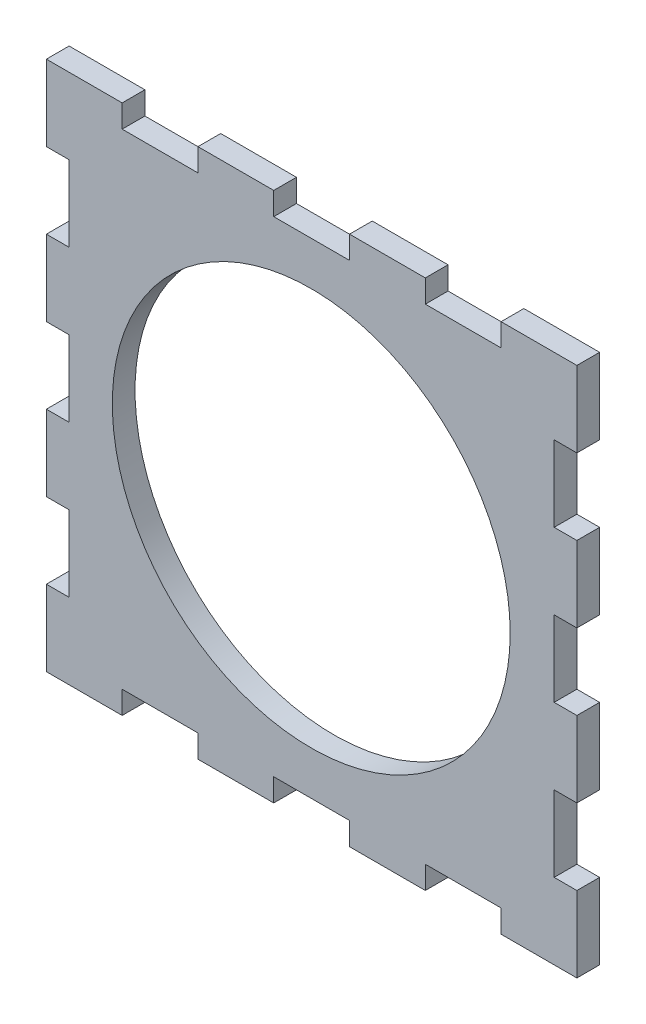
SolidWorks part; units mm, degrees
ref_plane "Front Plane" through (0, 0, 0) normal (0, 0, 1) x (1, 0, 0)
ref_plane "Top Plane" through (0, 0, 0) normal (0, 1, 0) x (1, 0, 0)
ref_plane "Right Plane" through (0, 0, 0) normal (1, 0, 0) x (0, 0, -1)
sketch "Sketch1" plane through (0, 0, 0) normal (0, 0, 1) x (1, 0, 0)
  line L1 (-28.6885, 13.1967) -> (41.3115, 13.1967)
  line L2 (-28.6885, 13.1967) -> (-28.6885, -56.8033)
  line L3 (-28.6885, -56.8033) -> (41.3115, -56.8033)
  line L4 (41.3115, 13.1967) -> (41.3115, -56.8033)
  line L5 (-28.6885, 13.1967) -> (41.3115, -56.8033) construction
  line L6 (-28.6885, -56.8033) -> (41.3115, 13.1967) construction
  point P4 (6.3115, -21.8033)
extrude "Boss-Extrude1" add sketch "Sketch1" along normal blind 3
sketch "Sketch2" plane through (0, 0, 3) normal (0, 0, 1) x (1, 0, 0)
  line L0 (41.3115, 13.1967) -> (-28.6885, 13.1967) construction
  line L1 (-18.6885, 13.1967) -> (-8.6885, 13.1967)
  line L2 (-18.6885, 13.1967) -> (-18.6885, 10.1967)
  line L3 (-18.6885, 10.1967) -> (-8.6885, 10.1967)
  line L4 (-8.6885, 13.1967) -> (-8.6885, 10.1967)
  line L5 (-18.6885, 13.1967) -> (-8.6885, 10.1967) construction
  line L6 (-18.6885, 10.1967) -> (-8.6885, 13.1967) construction
  line L7 (1.3115, 13.1967) -> (11.3115, 13.1967)
  line L8 (1.3115, 13.1967) -> (1.3115, 10.1967)
  line L9 (1.3115, 10.1967) -> (11.3115, 10.1967)
  line L10 (11.3115, 13.1967) -> (11.3115, 10.1967)
  line L11 (21.3115, 13.1967) -> (31.3115, 13.1967)
  line L12 (21.3115, 13.1967) -> (21.3115, 10.1967)
  line L13 (21.3115, 10.1967) -> (31.3115, 10.1967)
  line L14 (31.3115, 13.1967) -> (31.3115, 10.1967)
  line L15 (-18.6885, 13.1967) -> (1.3115, 13.1967) construction
  point P4 (-13.6885, 11.6967)
extrude "Cut-Extrude1" cut sketch "Sketch2" against normal blind 3
sketch "Sketch3" plane through (0, 0, 3) normal (0, 0, 1) x (1, 0, 0)
  line L0 (-28.6885, -56.8033) -> (41.3115, -56.8033) construction
  line L1 (-18.6885, -56.8033) -> (-8.6885, -56.8033)
  line L2 (-18.6885, -56.8033) -> (-18.6885, -53.8033)
  line L3 (-18.6885, -53.8033) -> (-8.6885, -53.8033)
  line L4 (-8.6885, -56.8033) -> (-8.6885, -53.8033)
  line L5 (-18.6885, -56.8033) -> (-8.6885, -53.8033) construction
  line L6 (-18.6885, -53.8033) -> (-8.6885, -56.8033) construction
  line L7 (11.3115, -56.8033) -> (11.3115, -53.8033)
  line L8 (1.3115, -53.8033) -> (11.3115, -53.8033)
  line L9 (1.3115, -56.8033) -> (1.3115, -53.8033)
  line L10 (1.3115, -56.8033) -> (11.3115, -56.8033)
  line L11 (31.3115, -56.8033) -> (31.3115, -53.8033)
  line L12 (21.3115, -53.8033) -> (31.3115, -53.8033)
  line L13 (21.3115, -56.8033) -> (21.3115, -53.8033)
  line L14 (21.3115, -56.8033) -> (31.3115, -56.8033)
  line L15 (-8.6885, -56.8033) -> (11.3115, -56.8033) construction
  point P4 (-13.6885, -55.3033)
extrude "Cut-Extrude2" cut sketch "Sketch3" against normal blind 3
sketch "Sketch4" plane through (0, 0, 3) normal (0, 0, 1) x (1, 0, 0)
  line L0 (-28.6885, 13.1967) -> (-28.6885, -56.8033) construction
  line L1 (-28.6885, 3.1967) -> (-25.6885, 3.1967)
  line L2 (-28.6885, 3.1967) -> (-28.6885, -6.8033)
  line L3 (-28.6885, -6.8033) -> (-25.6885, -6.8033)
  line L4 (-25.6885, 3.1967) -> (-25.6885, -6.8033)
  line L5 (-28.6885, 3.1967) -> (-25.6885, -6.8033) construction
  line L6 (-28.6885, -6.8033) -> (-25.6885, 3.1967) construction
  line L7 (-25.6885, -16.8033) -> (-25.6885, -26.8033)
  line L8 (-28.6885, -16.8033) -> (-28.6885, -26.8033)
  line L9 (-28.6885, -16.8033) -> (-25.6885, -16.8033)
  line L10 (-28.6885, -26.8033) -> (-25.6885, -26.8033)
  line L11 (-25.6885, -36.8033) -> (-25.6885, -46.8033)
  line L12 (-28.6885, -36.8033) -> (-28.6885, -46.8033)
  line L13 (-28.6885, -36.8033) -> (-25.6885, -36.8033)
  line L14 (-28.6885, -46.8033) -> (-25.6885, -46.8033)
  line L15 (-25.6885, 3.1967) -> (-25.6885, -16.8033) construction
  point P4 (-27.1885, -1.8033)
extrude "Cut-Extrude3" cut sketch "Sketch4" against normal blind 3
sketch "Sketch5" plane through (0, 0, 3) normal (0, 0, 1) x (1, 0, 0)
  line L0 (41.3115, -56.8033) -> (41.3115, 13.1967) construction
  line L1 (41.3115, 3.1967) -> (38.3115, 3.1967)
  line L2 (41.3115, 3.1967) -> (41.3115, -6.8033)
  line L3 (41.3115, -6.8033) -> (38.3115, -6.8033)
  line L4 (38.3115, 3.1967) -> (38.3115, -6.8033)
  line L5 (41.3115, 3.1967) -> (38.3115, -6.8033) construction
  line L6 (41.3115, -6.8033) -> (38.3115, 3.1967) construction
  line L7 (38.3115, -16.8033) -> (38.3115, -26.8033)
  line L8 (41.3115, -16.8033) -> (38.3115, -16.8033)
  line L9 (41.3115, -16.8033) -> (41.3115, -26.8033)
  line L10 (41.3115, -26.8033) -> (38.3115, -26.8033)
  line L11 (38.3115, -36.8033) -> (38.3115, -46.8033)
  line L12 (41.3115, -36.8033) -> (38.3115, -36.8033)
  line L13 (41.3115, -36.8033) -> (41.3115, -46.8033)
  line L14 (41.3115, -46.8033) -> (38.3115, -46.8033)
  line L15 (38.3115, 3.1967) -> (38.3115, -16.8033) construction
  point P4 (39.8115, -1.8033)
extrude "Cut-Extrude4" cut sketch "Sketch5" against normal blind 3
sketch "Sketch6" plane through (0, 0, 3) normal (0, 0, 1) x (1, 0, 0)
  line L0 (34.3609, 13.1967) -> (34.3609, -56.8033) construction
  line L1 (41.3115, 13.1967) -> (31.3115, 13.1967) construction
  line L2 (31.3115, -56.8033) -> (41.3115, -56.8033) construction
  line L3 (-21.8399, 13.1967) -> (-21.8399, -56.8033) construction
  line L4 (-18.6885, 13.1967) -> (-28.6885, 13.1967) construction
  line L5 (-28.6885, -56.8033) -> (-18.6885, -56.8033) construction
  line L6 (34.3609, -21.8033) -> (-21.8399, -21.8033) construction
  circle A0 centre (6.2605, -21.8033) radius 26.25
extrude "Cut-Extrude5" cut sketch "Sketch6" against normal blind 3
equation "\"length\"= 70mm"
equation "\"widhth\"= \"length\""
equation "\"height\"= 3mm"
equation "\"finger_l\"= 10mm"
equation "\"finger_w\"= \"height\""
equation "\"D1@Sketch1\"=\"length\""
equation "\"D2@Sketch1\"=\"widhth\""
equation "\"D1@Boss-Extrude1\"=\"height\""
equation "\"D1@Sketch2\"=\"finger_l\""
equation "\"D2@Sketch2\"=\"finger_w\""
equation "\"D1@Sketch3\"=\"finger_l\""
equation "\"D2@Sketch3\"=\"finger_w\""
equation "\"D1@Cut-Extrude2\"=\"height\""
equation "\"D1@Sketch4\"=\"finger_w\""
equation "\"D2@Sketch4\"=\"finger_l\""
equation "\"D1@Cut-Extrude3\"=\"height\""
equation "\"D1@Sketch5\"=\"height\""
equation "\"D2@Sketch5\"=\"finger_l\""
equation "\"D1@Cut-Extrude4\"=\"height\""
equation "\"D1@Sketch6\"=\"length\"*0.75"
equation "\"D1@Cut-Extrude5\"=\"height\""
